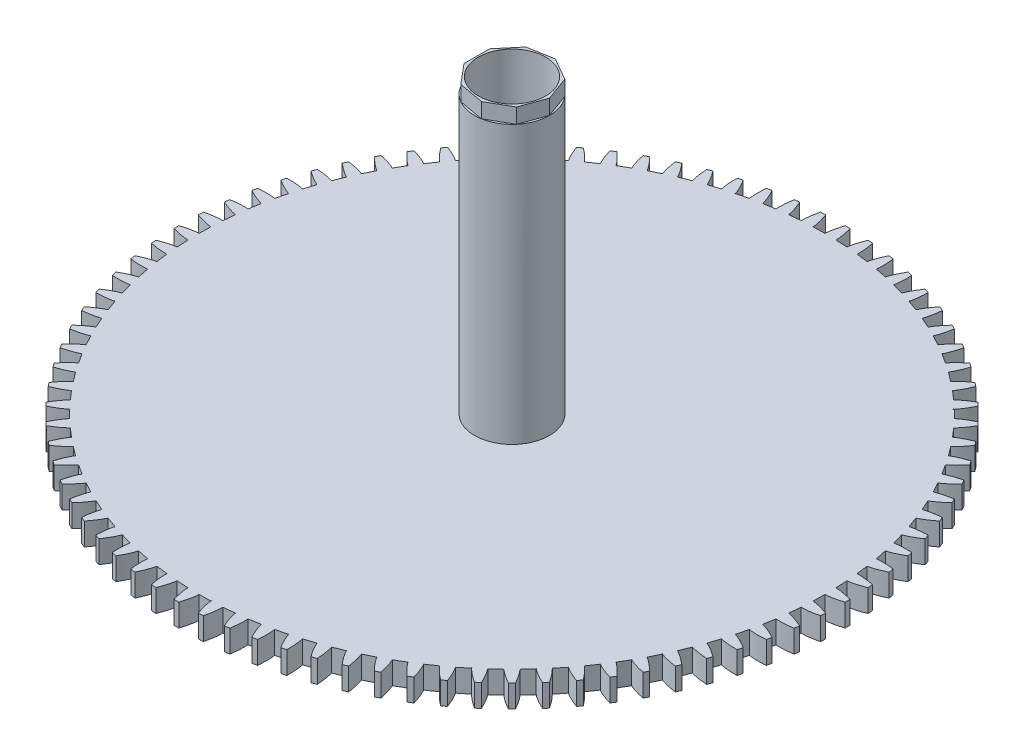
SolidWorks part; units mm, degrees
ref_plane "Front Plane" through (0, 0, 0) normal (0, 0, 1) x (1, 0, 0)
ref_plane "Top Plane" through (0, 0, 0) normal (0, 1, 0) x (1, 0, 0)
ref_plane "Right Plane" through (0, 0, 0) normal (1, 0, 0) x (0, 0, -1)
sketch "Sketch1" plane through (0, 0, 0) normal (0, 1, 0) x (1, 0, 0)
  line L0 (0, 0) -> (0, 20.8152) construction
  line L1 (0, 0) -> (-20.8152, 0) construction
  line L2 (0, 0) -> (-21.9963, -0.4018) construction
  line L3 (0, 0) -> (-20.8013, -0.7602) construction
  line L4 (0, 0) -> (-20.7596, -1.5194) construction
  circle A0 centre (0, 0) radius 21.5 construction
  circle A1 centre (0, 0) radius 20.8152 construction
  circle A2 centre (0, 0) radius 20.875 construction
  circle A3 centre (0, 0) radius 22 construction
  spline S0 degree 4 poles (-20.8152, 0) (-20.8518, 0) (-20.9546, -0.0038) (-21.1481, -0.0258) (-21.4608, -0.0826) (-21.8534, -0.1856) (-22.3513, -0.3531) (-22.9232, -0.5936) (-23.5332, -0.9024) (-24.1739, -1.2842) (-24.7904, -1.7051) (-25.3824, -2.1598) (-25.9498, -2.6446) (-26.6091, -3.2656) (-27.3591, -4.06) (-28.1717, -5.0485) (-29.0143, -6.2484) (-29.7821, -7.5292) (-30.4617, -8.8588) (-30.9809, -10.0577) (-31.3734, -11.1061) (-31.6662, -11.9916) (-31.88, -12.7065) (-32.1223, -13.6072) (-32.3314, -14.5163) (-32.4906, -15.3406) (-32.6098, -16.0771) (-32.6899, -16.631) (-32.7605, -17.1859) (-32.8196, -17.7428) (-32.8673, -18.2996) (-32.8995, -18.7666) (-32.9205, -19.1302) (-32.9416, -19.6109) (-32.9531, -19.9952) (-32.9652, -20.6867) (-32.958, -21.1945) (-32.9494, -21.7453) (-32.9362, -22.0017) (-32.9302, -22.1799) knots 0 0 0 0 0 0.005377 0.015084 0.028532 0.04661 0.064855 0.092111 0.119476 0.146842 0.174209 0.201575 0.228941 0.256307 0.307035 0.361767 0.4165 0.471232 0.525964 0.580697 0.608063 0.635429 0.662795 0.690161 0.744894 0.77226 0.785943 0.799626 0.826992 0.854358 0.868042 0.881725 0.895408 0.909091 0.931818 0.954545 0.977273 1 1 1 1 1 construction
  spline S1 degree 4 poles (-20.8152, 0) (-20.8518, 0) (-20.9546, -0.0038) (-21.1481, -0.0258) (-21.4608, -0.0826) (-21.8534, -0.1856) (-22.3513, -0.3531) (-22.9232, -0.5936) (-23.5332, -0.9024) (-24.1739, -1.2842) (-24.7904, -1.7051) (-25.3824, -2.1598) (-25.9498, -2.6446) (-26.6091, -3.2656) (-27.3591, -4.06) (-28.1717, -5.0485) (-29.0143, -6.2484) (-29.7821, -7.5292) (-30.4617, -8.8588) (-30.9809, -10.0577) (-31.3734, -11.1061) (-31.6662, -11.9916) (-31.88, -12.7065) (-32.1223, -13.6072) (-32.3314, -14.5163) (-32.4906, -15.3406) (-32.6098, -16.0771) (-32.6899, -16.631) (-32.7605, -17.1859) (-32.8196, -17.7428) (-32.8673, -18.2996) (-32.8995, -18.7666) (-32.9205, -19.1302) (-32.9341, -19.4396) (-32.9406, -19.6121) (-32.9434, -19.6968) knots 0 0 0 0 0 0.005377 0.015084 0.028532 0.04661 0.064855 0.092111 0.119476 0.146842 0.174209 0.201575 0.228941 0.256307 0.307035 0.361767 0.4165 0.471232 0.525964 0.580697 0.608063 0.635429 0.662795 0.690161 0.744894 0.77226 0.785943 0.799626 0.826992 0.854358 0.868042 0.881725 0.895408 0.909091 0.909091 0.909091 0.909091 0.909091
  dimension "D1" = 44
  dimension "D2" = 43
  dimension "D3" = 41.6303
  dimension "D4" = 41.75
  dimension "D5" = 20.8152
  dimension "D6" = 1.047
  dimension "D7" = 2.093
  dimension "D8" = 4.186
sketch "Sketch2" plane through (0, 0, 0) normal (0, 1, 0) x (1, 0, 0)
  line L0 (0, 0) -> (-21.9963, -0.4018) construction
  line L1 (0, 0) -> (-21.9963, -0.4018) construction
  line L2 (0, 0) -> (-20.8013, -0.7602) construction
  line L3 (0, 0) -> (-20.8152, 0) construction
  line L4 (0, 0) -> (-20.7596, -1.5194) construction
  line L5 (0, 0) -> (-20.8013, -0.7602) construction
  line L6 (0, 0) -> (-20.8152, 0) construction
  line L7 (0, 0) -> (-20.7596, -1.5194) construction
  line L8 (-20.875, 0) -> (-20.8611, -0.7624) construction
  line L9 (-20.8611, -0.7624) -> (-20.8193, -1.5238)
  line L10 (-20.8193, -1.5238) -> (-20.7596, -1.5194) construction
  line L11 (-20.8193, -1.5238) -> (-2.244, -0.1642)
  line L12 (-20.8152, 0) -> (-2.25, 0)
  circle A0 centre (0, 0) radius 20.875 construction
  circle A1 centre (0, 0) radius 20.8152 construction
  circle A2 centre (0, 0) radius 21.5 construction
  circle A3 centre (0, 0) radius 22 construction
  circle A4 centre (0, 0) radius 20.875 construction
  circle A5 centre (0, 0) radius 20.8152 construction
  circle A6 centre (0, 0) radius 21.5 construction
  circle A7 centre (0, 0) radius 22 construction
  arc A8 (-21.9927, -0.5657) -> (-21.9987, -0.2379) centre (0, 0) cw
  circle A11 centre (0, 0) radius 2.25 construction
  arc A12 (-2.25, 0) -> (-2.244, -0.1642) centre (0, 0) ccw
  spline S2 degree 4 poles (-20.8611, -0.7624) (-20.8685, -0.7621) (-20.9525, -0.7585) (-21.142, -0.7417) (-21.4268, -0.7001) (-21.701, -0.6414) (-21.8985, -0.5913) (-21.9927, -0.5657) knots 0.004428 0.004428 0.004428 0.004428 0.004428 0.005377 0.015084 0.028532 0.040915 0.040915 0.040915 0.040915 0.040915
  spline S3 degree 4 poles (-78.0062, -1999.0207) (-15.1603, -47.2526) (-16.4903, -1.0471) (-19.0617, 0.3537) (-21.4608, -0.0826) (-21.8534, -0.1856) (-22.3513, -0.3531) (-22.9232, -0.5936) (-23.5332, -0.9024) (-24.1739, -1.2842) (-24.7904, -1.7051) (-25.3824, -2.1598) (-25.9498, -2.6446) (-26.6091, -3.2656) (-27.3591, -4.06) (-28.1717, -5.0485) (-29.0143, -6.2484) (-29.7821, -7.5292) (-30.4617, -8.8588) (-30.9809, -10.0577) (-31.3734, -11.1061) (-31.6662, -11.9916) (-31.88, -12.7065) (-32.1223, -13.6072) (-32.3314, -14.5163) (-32.4906, -15.3406) (-32.6098, -16.0771) (-32.6899, -16.631) (-32.7605, -17.1859) (-32.8196, -17.7428) (-32.8673, -18.2996) (-32.8995, -18.7666) (-33.0213, -20.8767) (-33.0211, -24.9047) (-30.9414, 29.1408) (-98.6457, -2018.4397) knots -0.310976 -0.310976 -0.310976 -0.310976 -0.310976 0.005377 0.015084 0.028532 0.04661 0.064855 0.092111 0.119476 0.146842 0.174209 0.201575 0.228941 0.256307 0.307035 0.361767 0.4165 0.471232 0.525964 0.580697 0.608063 0.635429 0.662795 0.690161 0.744894 0.77226 0.785943 0.799626 0.826992 0.854358 0.868042 0.881725 0.895408 1.171971 1.171971 1.171971 1.171971 1.171971 only from (-20.8152, 0) to (-32.9434, -19.6968) construction
  spline S4 degree 4 poles (-20.8152, 0) (-20.8518, 0) (-20.9546, -0.0038) (-21.1481, -0.0258) (-21.4462, -0.08) (-21.7042, -0.1465) (-21.8957, -0.2044) (-21.9987, -0.2379) knots 0 0 0 0 0 0.005377 0.015084 0.028532 0.04443 0.04443 0.04443 0.04443 0.04443
  point P18 (-20.868, -0.3812)
  point P24 (-20.8193, -1.5238)
  dimension "D2" = 4.5
extrude "Boss-Extrude1" add sketch "Sketch2" along normal blind 1.5
pattern_circular "CirPattern1" count 86 over 360 of "Boss-Extrude1"
sketch "Sketch3" plane through (0, 1.5, 0) normal (0, 1, 0) x (1, 0, 0)
  circle A0 centre (0, 0) radius 2.25
  circle A1 centre (0, 0) radius 2.5
  circle A2 centre (0, 0) radius 2.25 construction
  dimension "D1" = 0.25
extrude "Boss-Extrude2" add sketch "Sketch3" along normal blind 19.5
sketch "Sketch4" plane through (0, 21, 0) normal (0, 1, 0) x (1, 0, 0)
  line L0 (1.9151, -1.607) -> (2.5, 0)
  line L1 (2.5, 0) -> (1.9151, 1.607)
  line L2 (1.9151, 1.607) -> (0.4341, 2.462)
  line L3 (0.4341, 2.462) -> (-1.25, 2.1651)
  line L4 (-1.25, 2.1651) -> (-2.3492, 0.8551)
  line L5 (-2.3492, 0.8551) -> (-2.3492, -0.8551)
  line L6 (-2.3492, -0.8551) -> (-1.25, -2.1651)
  line L7 (-1.25, -2.1651) -> (0.4341, -2.462)
  line L8 (0.4341, -2.462) -> (1.9151, -1.607)
  circle A0 centre (0, 0) radius 2.5
  circle A1 centre (0, 0) radius 2.5 construction
extrude "Cut-Extrude1" cut sketch "Sketch4" against normal blind 1 contours L5 M1 | L4 M1 | L3 M1 | L2 M1 | L1 M1 | L0 M1 | L7 M1 | L6 M1 | L8 M1 | A0
equation "\"Module\"= .5"
equation "\"Number of Teeth\"= 86"
equation "\"Pressure Angle\"= 14.5deg"
equation "\"Pitch Diameter\"= \"Number of Teeth\" * \"Module\""
equation "\"Circular Pitch\"= pi * \"Module\""
equation "\"Addendum\"= \"Module\""
equation "\"Dedendum\"= 1.25 * \"Module\""
equation "\"Base Diameter\"= \"Pitch Diameter\" * cos ( \"Pressure Angle\" )"
equation "\"Base Radius\"= \"Base Diameter\" / 2"
equation "\"Width\"= 1.5mm"
equation "\"Outside Diameter\"= \"Pitch Diameter\" + 2 * \"Addendum\""
equation "\"D1@Sketch1\"=\"Outside Diameter\""
equation "\"D3@Sketch1\"=\"Base Diameter\""
equation "\"Root Diameter\"= \"Pitch Diameter\" - 2 * \"Dedendum\""
equation "\"D4@Sketch1\"=\"Root Diameter\""
equation "\"Tooth Angle\"= 360 / \"Number of Teeth\""
equation "\"D6@Sketch1\"=\"Tooth Angle\"/4"
equation "\"D7@Sketch1\"=\"Tooth Angle\"/2"
equation "\"D8@Sketch1\"=\"Tooth Angle\""
equation "\"D2@Sketch1\" = \"Pitch Diameter\""
equation "\"Shaft Diameter\"= 4.5"
equation "\"D1@CirPattern1\" = \"Number of Teeth\""
equation "\"D2@Sketch2\"  = \"Shaft Diameter\""
equation "\"D1@Boss-Extrude1\" = \"Width\""
